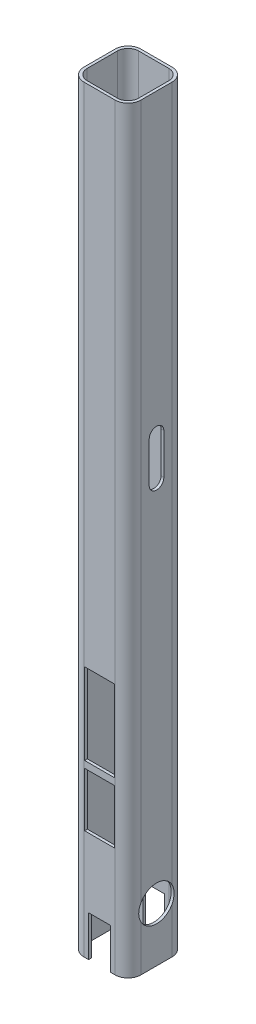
SolidWorks part; units mm, degrees
ref_plane "Front Plane" through (0, 0, 0) normal (0, 0, 1) x (1, 0, 0)
ref_plane "Top Plane" through (0, 0, 0) normal (0, 1, 0) x (1, 0, 0)
ref_plane "Right Plane" through (0, 0, 0) normal (1, 0, 0) x (0, 0, -1)
sketch "Sketch1" plane through (0, 0, 0) normal (0, 1, 0) x (1, 0, 0)
  line L0 (-5.5562, 9.525) -> (5.5562, 9.525)
  line L1 (-5.7785, -10.541) -> (5.7785, -10.541)
  line L2 (-10.541, -5.7785) -> (-10.541, 5.7785)
  line L3 (-5.7785, 10.541) -> (5.7785, 10.541)
  line L4 (10.541, -5.7785) -> (10.541, 5.7785)
  line L5 (-10.541, -10.541) -> (10.541, 10.541) construction
  line L6 (-10.541, 10.541) -> (10.541, -10.541) construction
  line L7 (9.525, -5.5562) -> (9.525, 5.5562)
  line L8 (-5.5562, -9.525) -> (5.5562, -9.525)
  line L9 (-9.525, -5.5562) -> (-9.525, 5.5562)
  line L10 (-9.525, -9.525) -> (9.525, -9.525) construction
  line L11 (-9.525, -9.525) -> (-9.525, 9.525) construction
  line L12 (9.525, -9.525) -> (9.525, 9.525) construction
  line L13 (-9.525, 9.525) -> (9.525, 9.525) construction
  line L14 (-10.541, -10.541) -> (10.541, -10.541) construction
  line L15 (-10.541, -10.541) -> (-10.541, 10.541) construction
  line L16 (10.541, -10.541) -> (10.541, 10.541) construction
  line L17 (-10.541, 10.541) -> (10.541, 10.541) construction
  arc A0 (-5.5562, -9.525) -> (-9.525, -5.5562) centre (-5.5563, -5.5563) cw
  arc A1 (9.525, -5.5562) -> (5.5562, -9.525) centre (5.5563, -5.5563) cw
  arc A2 (5.5562, 9.525) -> (9.525, 5.5562) centre (5.5563, 5.5563) cw
  arc A3 (-5.5562, 9.525) -> (-9.525, 5.5562) centre (-5.5563, 5.5563) ccw
  arc A4 (-5.7785, -10.541) -> (-10.541, -5.7785) centre (-5.7785, -5.7785) cw
  arc A5 (5.7785, -10.541) -> (10.541, -5.7785) centre (5.7785, -5.7785) ccw
  arc A6 (5.7785, 10.541) -> (10.541, 5.7785) centre (5.7785, 5.7785) cw
  arc A7 (-10.541, 5.7785) -> (-5.7785, 10.541) centre (-5.7785, 5.7785) cw
  point P0 (0, 0)
  dimension "D3" = 3.9688
  dimension "D4" = 4.7625
  dimension "D1" = 21.082
  dimension "D2" = 1.016
extrude "Boss-Extrude1" add sketch "Sketch1" along normal blind 280
sketch "Sketch2" plane through (10.541, 0, 0) normal (1, 0, 0) x (0, 0, -1)
  circle A0 centre (0, 20) radius 6.525
  dimension "D1" = 13.05
  dimension "D2" = 20
extrude "Cut-Extrude1" cut sketch "Sketch2" against normal through all
sketch "Sketch3" plane through (0, 0, -10.541) normal (0, 0, -1) x (-1, 0, 0)
  line L0 (-10.541, 20) -> (10.541, 20) construction
  line L1 (-4, -15) -> (4, -15)
  line L2 (-4, -15) -> (-4, 15)
  line L3 (-4, 15) -> (4, 15)
  line L4 (4, -15) -> (4, 15)
  line L5 (-4, -15) -> (4, 15) construction
  line L6 (-4, 15) -> (4, -15) construction
  line L7 (-10.541, 280) -> (-10.541, 23.0306) construction
  line L8 (10.541, 280) -> (10.541, 23.0306) construction
  line L9 (5.7785, 0) -> (10.541, 0) construction
  line L10 (0, 20) -> (0, 60.5) construction
  line L11 (-5.5, 60.5) -> (5.5, 60.5)
  line L12 (5.5, 60.5) -> (5.5, 40.5)
  line L13 (5.5, 40.5) -> (-5.5, 40.5)
  line L18 (-5.5, 60.5) -> (-5.5, 40.5)
  point P0 (0, 0)
  point P22 (0, 40.5)
  dimension "D1" = 30
  dimension "D2" = 8
  dimension "D3" = 20
  dimension "D4" = 40.5
  dimension "D5" = 20
  dimension "D6" = 11
extrude "Cut-Extrude2" cut sketch "Sketch3" against normal through all
sketch "Sketch4" plane through (0, 0, -10.541) normal (0, 0, -1) x (-1, 0, 0)
  line L0 (0, 0) -> (0, 280) construction
  line L1 (-5.7785, 280) -> (5.7785, 280) construction
  line L3 (-5.5, 97) -> (5.5, 97)
  line L4 (-5.5, 97) -> (-5.5, 132)
  line L5 (-5.5, 132) -> (5.5, 132)
  line L6 (5.5, 97) -> (5.5, 132)
  line L7 (-5.5, 97) -> (5.5, 132) construction
  line L8 (-5.5, 132) -> (5.5, 97) construction
  point P5 (0, 114.5)
  dimension "D1" = 11
  dimension "D2" = 35
  dimension "D3" = 114.5
extrude "Cut-Extrude3" cut sketch "Sketch4" against normal blind 10
sketch "Sketch5" plane through (0, 0, 10.541) normal (0, 0, 1) x (1, 0, 0)
  line L0 (0, 0) -> (0, 280) construction
  line L1 (-5.7785, 280) -> (5.7785, 280) construction
  line L3 (-5.5, 63) -> (5.5, 63)
  line L4 (-5.5, 63) -> (-5.5, 93)
  line L5 (-5.5, 93) -> (5.5, 93)
  line L6 (5.5, 63) -> (5.5, 93)
  line L7 (-5.5, 63) -> (5.5, 93) construction
  line L8 (-5.5, 93) -> (5.5, 63) construction
  point P5 (0, 78)
  dimension "D1" = 11
  dimension "D2" = 30
  dimension "D3" = 78
extrude "Cut-Extrude4" cut sketch "Sketch5" against normal blind 10
sketch "Sketch8" plane through (10.541, 0, 0) normal (1, 0, 0) x (0, 0, -1)
  line L0 (0, 280) -> (0, 180) construction
  line L1 (-5.7785, 280) -> (5.7785, 280) construction
  line L2 (0, 170) -> (0, 155) construction
  line L3 (2.7, 170) -> (2.7, 155)
  line L4 (-2.7, 170) -> (-2.7, 155)
  arc A0 (2.7, 170) -> (-2.7, 170) centre (0, 170) ccw
  arc A1 (-2.7, 155) -> (2.7, 155) centre (0, 155) ccw
  point P7 (0, 162.5)
  dimension "D1" = 100
  dimension "D2" = 5.4
  dimension "D3" = 15
  dimension "D4" = 17.5
extrude "Cut-Extrude7" cut sketch "Sketch8" against normal through all
